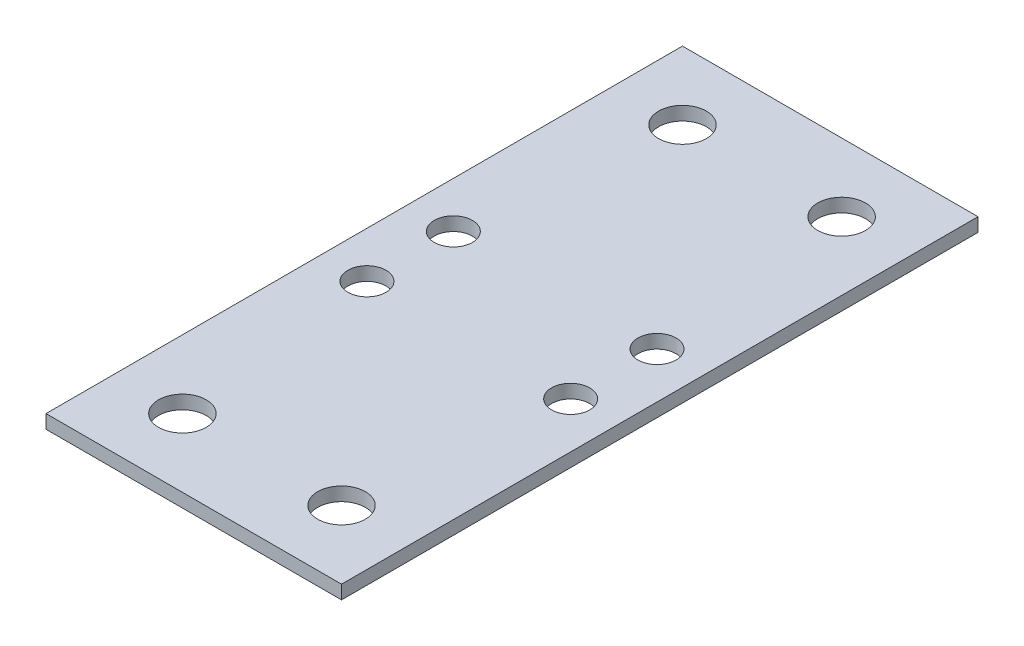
SolidWorks part; units mm, degrees
ref_plane "Piano frontale" through (0, 0, 0) normal (0, 0, 1) x (1, 0, 0)
ref_plane "Piano superiore" through (0, 0, 0) normal (0, 1, 0) x (1, 0, 0)
ref_plane "Piano destro" through (0, 0, 0) normal (1, 0, 0) x (0, 0, -1)
sketch "Schizzo3" plane through (0, 0, 0) normal (0, 1, 0) x (1, 0, 0)
  line L1 (-32.5, -70) -> (32.5, -70)
  line L2 (-32.5, -70) -> (-32.5, 70)
  line L3 (-32.5, 70) -> (32.5, 70)
  line L4 (32.5, -70) -> (32.5, 70)
  line L5 (-32.5, -70) -> (32.5, 70) construction
  line L6 (-32.5, 70) -> (32.5, -70) construction
  point P0 (0, 0)
extrude "Estrusione-Estrusione1" add sketch "Schizzo3" along normal blind 3
sketch "Schizzo4" plane through (0, 0, 0) normal (0, -1, 0) x (-1, 0, 0)
  point P0 (22.4, -9.5)
  point P1 (-22.4, -9.5)
  point P2 (17.5, -55)
  point P3 (22.4, 9.5)
  point P4 (-22.4, 9.5)
  point P5 (-17.5, -55)
  point P6 (17.5, 55)
  point P7 (-17.5, 55)
hole_wizard "Foro per Vite M8-1" positions "Schizzo6" profile "Schizzo5" hole size "M8" standard "ISO"
sketch "Schizzo6" plane through (0, 0, 0) normal (0, -1, 0) x (-1, 0, 0)
  point P0 (22.4, -9.5)
  point P3 (-22.4, -9.5)
  point P6 (-22.4, 9.5)
  point P9 (22.4, 9.5)
sketch "Schizzo5" plane through (-22.4, 0, 9.5) normal (1, 0, 0) x (0, 0, -1)
  line L0 (0, 0) -> (0, 3)
  line L1 (0, 3) -> (4.2, 3)
  line L2 (4.2, 3) -> (4.2, 0)
  line L5 (4.2, 0) -> (0, 0)
  line L11 (0, -6.35) -> (0, 107.95) construction
  dimension "Thru Hole Dia." = 8.4
  dimension "Thru Hole Depth" = 3
hole_wizard "Foro per Vite M10-1" positions "Schizzo8" profile "Schizzo7" hole size "M10" standard "ISO"
sketch "Schizzo8" plane through (0, 0, 0) normal (0, -1, 0) x (-1, 0, 0)
  point P0 (-17.5, -55)
  point P3 (-17.5, 55)
  point P6 (17.5, 55)
  point P9 (17.5, -55)
sketch "Schizzo7" plane through (17.5, 0, 55) normal (1, 0, 0) x (0, 0, -1)
  line L0 (0, 0) -> (0, 33.1545)
  line L1 (0, 33.1545) -> (5.25, 30)
  line L2 (5.25, 30) -> (5.25, 0)
  line L5 (5.25, 0) -> (0, 0)
  line L10 (0, 33.1545) -> (-5.25, 30) construction
  line L11 (0, -6.35) -> (0, 107.95) construction
  dimension "Hole Dia." = 10.5
  dimension "Hole Depth" = 30
  dimension "Drill Angle" = 118
